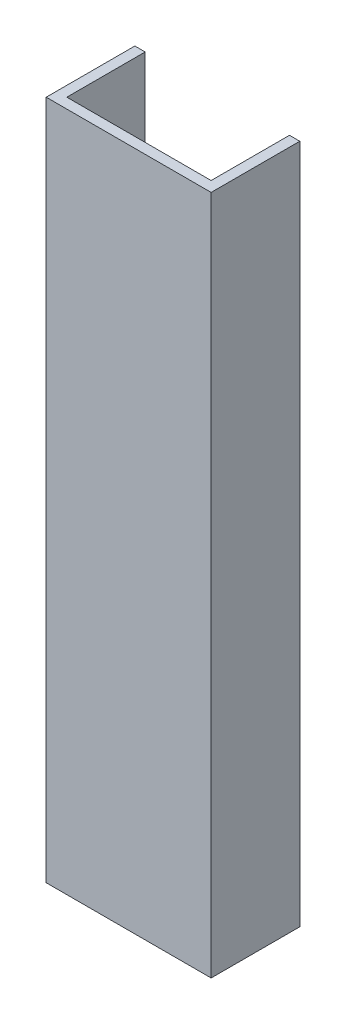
SolidWorks part; units mm, degrees
ref_plane "Front Plane" through (0, 0, 0) normal (0, 0, 1) x (1, 0, 0)
ref_plane "Top Plane" through (0, 0, 0) normal (0, 1, 0) x (1, 0, 0)
ref_plane "Right Plane" through (0, 0, 0) normal (1, 0, 0) x (0, 0, -1)
sketch "Sketch1" plane through (0, 0, 0) normal (0, 1, 0) x (1, 0, 0)
  line L0 (35, 43) -> (35, 5)
  line L1 (-40, 0) -> (40, 0)
  line L2 (-40, 0) -> (-40, 43)
  line L3 (-40, 43) -> (-35, 43)
  line L4 (40, 0) -> (40, 43)
  line L5 (35, 5) -> (-35, 5)
  line L6 (-35, 5) -> (-35, 43)
  line L7 (35, 43) -> (40, 43)
  dimension "D3" = 5
  dimension "D1" = 80
  dimension "D2" = 43
  dimension "D4" = 5
extrude "Boss-Extrude1" add sketch "Sketch1" along normal blind 330
